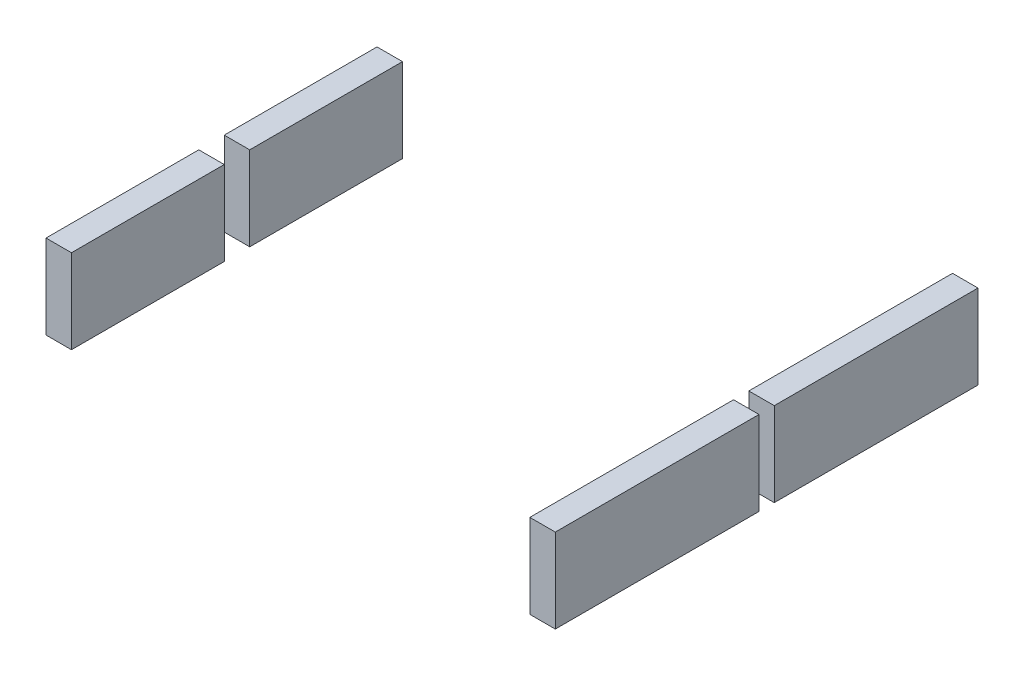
SolidWorks part; units mm, degrees
ref_plane "Front Plane" through (0, 0, 0) normal (0, 0, 1) x (1, 0, 0)
ref_plane "Top Plane" through (0, 0, 0) normal (0, 1, 0) x (1, 0, 0)
ref_plane "Right Plane" through (0, 0, 0) normal (1, 0, 0) x (0, 0, -1)
sketch "Sketch1" plane through (0, 0, 0) normal (0, 1, 0) x (1, 0, 0)
  line L0 (-49.53, 0) -> (-49.53, 33.02) construction
  line L1 (0, 0) -> (-2.54, 0)
  line L2 (0, 0) -> (0, 20.32)
  line L3 (0, 20.32) -> (-2.54, 20.32)
  line L4 (-2.54, 0) -> (-2.54, 20.32)
  line L5 (0, 21.844) -> (-2.54, 21.844)
  line L6 (0, 21.844) -> (0, 42.164)
  line L7 (0, 42.164) -> (-2.54, 42.164)
  line L8 (-2.54, 21.844) -> (-2.54, 42.164)
  line L9 (-48.26, 0) -> (-50.8, 0)
  line L10 (-48.26, 0) -> (-48.26, 15.24)
  line L11 (-48.26, 15.24) -> (-50.8, 15.24)
  line L12 (-50.8, 0) -> (-50.8, 15.24)
  line L13 (-48.26, 17.78) -> (-50.8, 17.78)
  line L14 (-48.26, 17.78) -> (-48.26, 33.02)
  line L15 (-48.26, 33.02) -> (-50.8, 33.02)
  line L16 (-50.8, 17.78) -> (-50.8, 33.02)
  line L17 (-1.27, 0) -> (-1.27, 42.164) construction
  dimension "D1" = 2.54
  dimension "D2" = 20.32
  dimension "D3" = 2.54
  dimension "D4" = 15.24
  dimension "D5" = 48.26
  dimension "D6" = 2.54
  dimension "D7" = 1.524
extrude "Boss-Extrude1" add sketch "Sketch1" along normal blind 8.382
